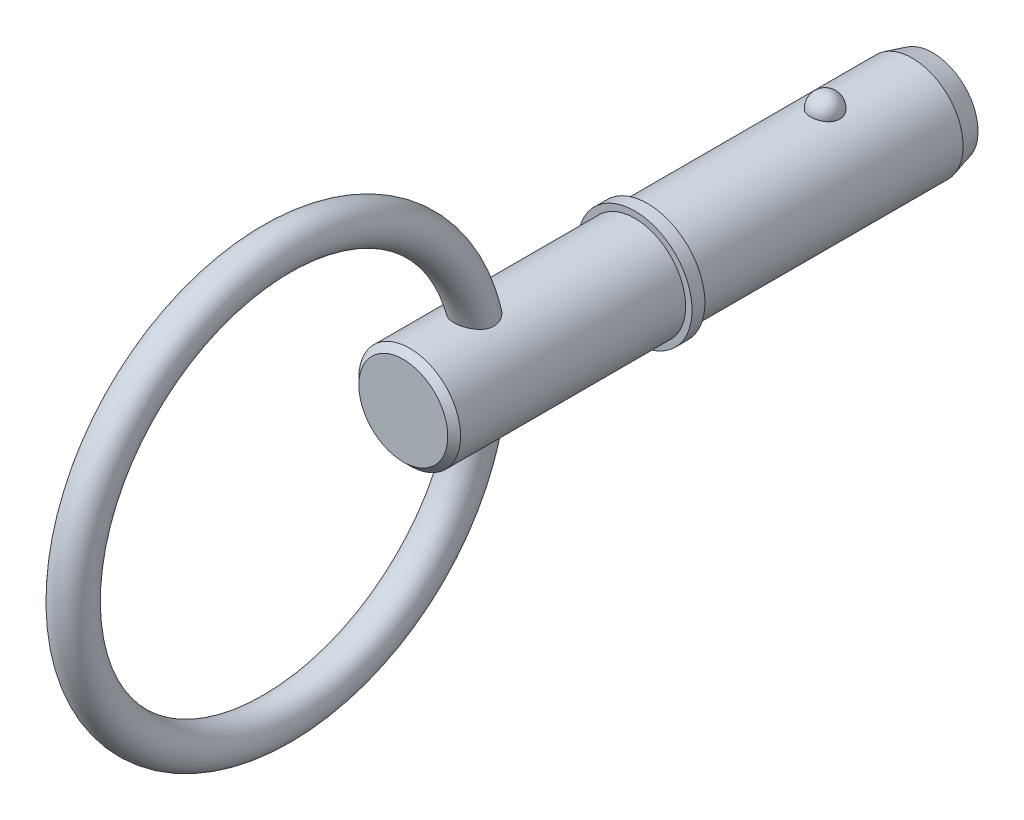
SolidWorks part; units mm, degrees
ref_plane "Front Plane" through (0, 0, 0) normal (0, 0, 1) x (1, 0, 0)
ref_plane "Top Plane" through (0, 0, 0) normal (0, 1, 0) x (1, 0, 0)
ref_plane "Right Plane" through (0, 0, 0) normal (1, 0, 0) x (0, 0, -1)
sketch "Sketch2" plane through (0, 0, 0) normal (0, 0, 1) x (1, 0, 0)
  circle A0 centre (0, 0) radius 3.97
  point P3 (0, 3.97)
  dimension "D1" = 7.94
extrude "Boss-Extrude1" add sketch "Sketch2" along normal blind 12.7
sketch "Sketch3" plane through (0, 0, 0) normal (0, 0, -1) x (-1, 0, 0)
  circle A0 centre (0, 0) radius 3.97
  dimension "D1" = 7.94
extrude "Boss-Extrude2" add sketch "Sketch3" along normal blind 9.53
chamfer "Chamfer1" distance 1.586 angle 15 1 edges at (-3.97, 0, -9.53)
sketch "Sketch18" plane through (0, 0, 0) normal (1, 0, 0) x (0, 0, -1)
  line L0 (7.944, 3.97) -> (-12.7, 3.97) construction
  line L1 (1.15, 5.12) -> (1.15, 2.82)
  line L2 (-12.7, -3.97) -> (7.944, -3.97) construction
  arc A0 (1.15, 5.12) -> (1.15, 2.82) centre (1.15, 3.97) ccw
  point P4 (0, 3.97)
  dimension "D1" = 9.09
revolve "Revolve1" add sketch "Sketch18" angle 360 about L1
sketch "Sketch19" plane through (0, 0, 0) normal (1, 0, 0) x (0, 0, -1)
  line L0 (-33.7288, 0) -> (-46.4542, 0) construction
sketch "Sketch20" plane through (0, 0, 0) normal (1, 0, 0) x (0, 0, -1)
  line L0 (-12.7, 0) -> (-12.7, 4.47)
  line L1 (-12.7, 3.97) -> (-12.7, -3.97) construction
  line L2 (-12.7, 4.47) -> (-13.7, 4.47)
  line L3 (-13.7, 4.47) -> (-13.7, 0)
  line L4 (-33.7288, 0) -> (-46.4542, 0) construction
  line L5 (-13.7, 0) -> (-12.7, 0)
  dimension "D1" = 4.47
  dimension "D2" = 1
revolve "Revolve2" add sketch "Sketch20" angle 360 about L0
sketch "Sketch21" plane through (0, 0, 12.7) normal (0, 0, -1) x (-1, 0, 0)
  circle A0 centre (0, 0) radius 3.97
  dimension "D1" = 7.94
extrude "Boss-Extrude3" add sketch "Sketch21" against normal blind 19.05
chamfer "Chamfer2" distance 0.5 angle 45 1 edges at (-3.97, 0, 31.75)
sketch "Sketch23" plane through (0, 0, 0) normal (1, 0, 0) x (0, 0, -1)
  line L0 (-31.75, 3.47) -> (-31.75, -3.47) construction
  circle A0 centre (-41.625, 0) radius 15.875
  point P2 (-25.75, 0)
  dimension "D1" = 31.75
  dimension "D2" = 6
sketch "Sketch24" plane through (0, 0, 0) normal (0, 1, 0) x (1, 0, 0)
  circle A0 centre (0, -25.75) radius 1.5
  dimension "D1" = 3
sweep "Sweep1" add profiles "Sketch24" path "Sketch23"
